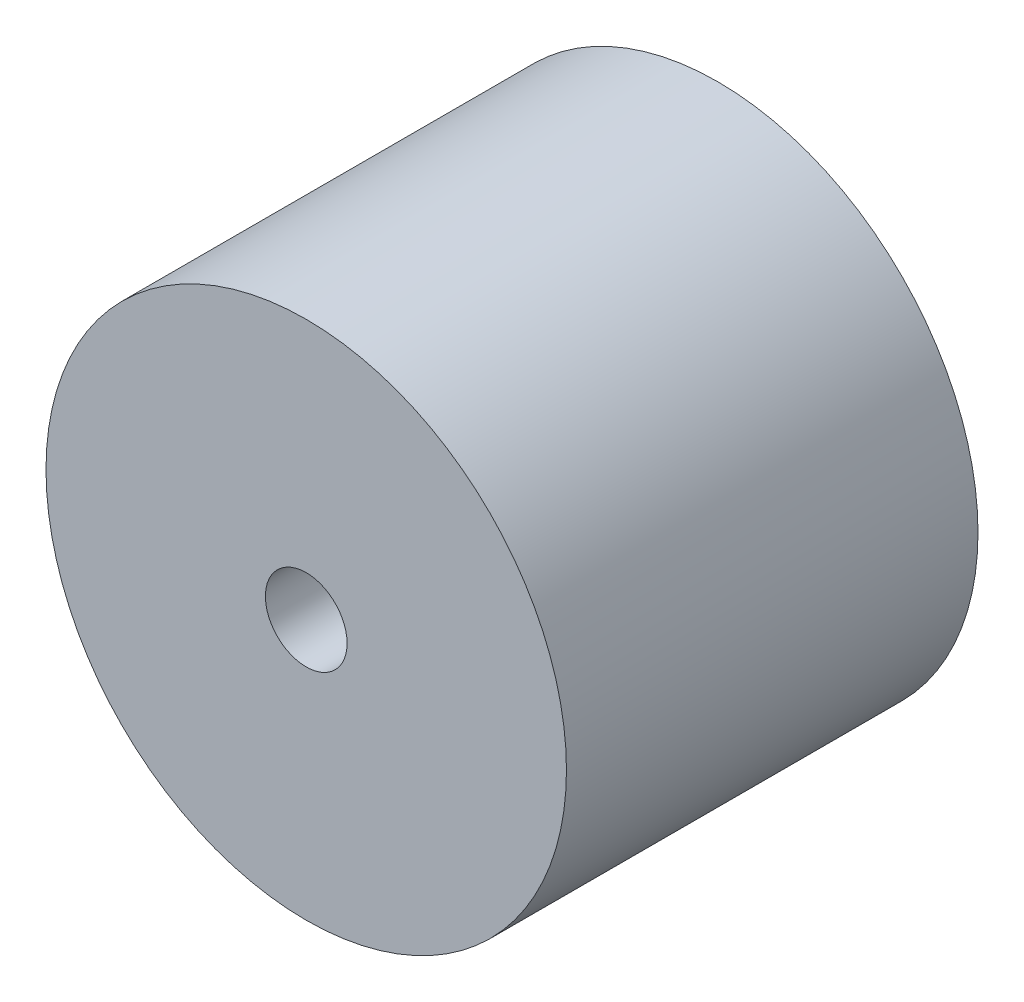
SolidWorks part; units mm, degrees
ref_plane "Face" through (0, 0, 0) normal (0, 0, 1) x (1, 0, 0)
ref_plane "Dessus" through (0, 0, 0) normal (0, 1, 0) x (1, 0, 0)
ref_plane "Droite" through (0, 0, 0) normal (1, 0, 0) x (0, 0, -1)
sketch "Esquisse1" plane through (0, 0, 0) normal (0, 0, 1) x (1, 0, 0)
  circle A0 centre (0, 0) radius 43
  circle A1 centre (0, 0) radius 6.75
  dimension "D1" = 13.5
  dimension "D2" = 86
extrude "Boss.-Extru.1" add sketch "Esquisse1" along normal mid plane 68
